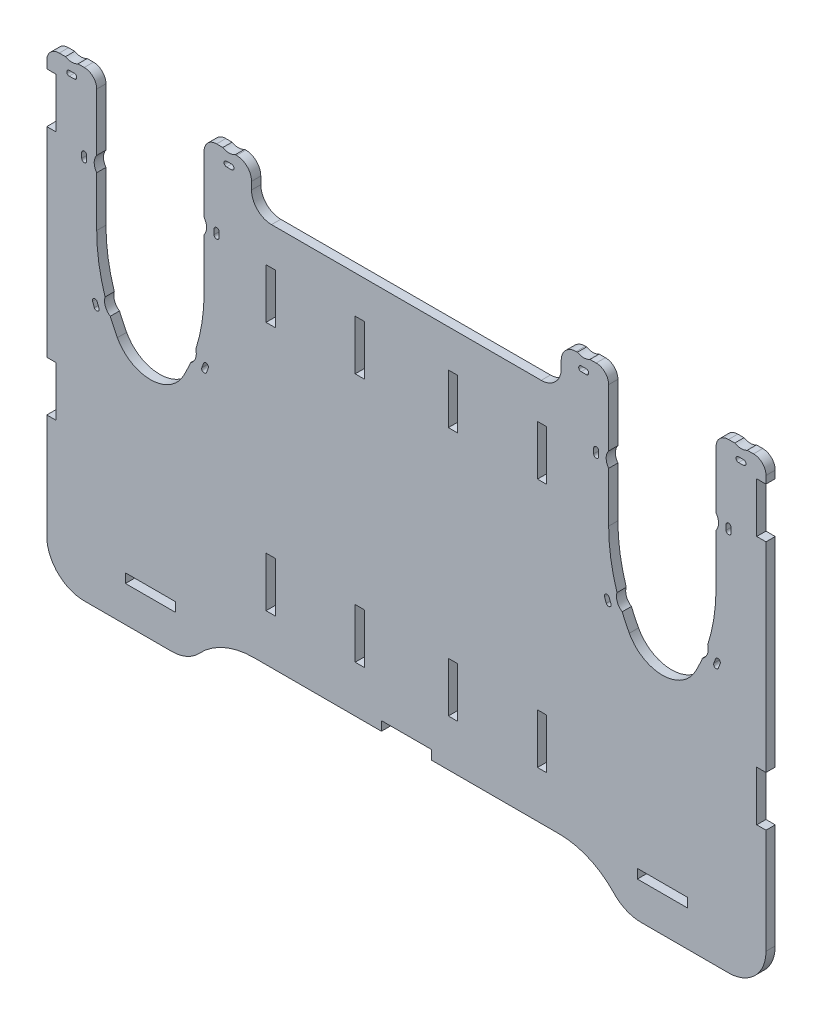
SolidWorks part; units mm, degrees
ref_plane "Front Plane" through (0, 0, 0) normal (0, 0, 1) x (1, 0, 0)
ref_plane "Top Plane" through (0, 0, 0) normal (0, 1, 0) x (1, 0, 0)
ref_plane "Right Plane" through (0, 0, 0) normal (1, 0, 0) x (0, 0, -1)
sketch "Sketch1" plane through (0, 0, 0) normal (0, 0, 1) x (1, 0, 0)
  line L0 (16.8, 115) -> (16.8, 35) construction
  line L1 (0, 150) -> (54, 150)
  line L2 (129, 167) -> (131.5, 167)
  line L3 (16.8, 135) -> (20.5, 135)
  line L4 (144, 162) -> (144, 159)
  line L5 (16.8, 135) -> (16.8, 115)
  line L6 (16.8, 115) -> (20.5, 115)
  line L7 (20.5, 135) -> (20.5, 115)
  line L8 (20.5, 135) -> (52.5, 135) construction
  line L9 (0, 0) -> (0, -18) construction
  line L10 (81, 162) -> (81, 139)
  line L11 (56.2, 115) -> (56.2, 35) construction
  line L12 (124, 162) -> (124, 139)
  line L13 (52.5, 135) -> (56.2, 135)
  line L14 (94, -18) -> (129, -18)
  line L15 (102.5, 87) -> (102.5, 72) construction
  line L16 (62, 158) -> (62, 161)
  line L17 (52.5, 135) -> (52.5, 115)
  line L18 (68, 167) -> (68.5, 167)
  line L19 (76, 136) -> (129, 136) construction
  line L20 (129, 135) -> (129, 137) construction
  line L21 (128, 135) -> (128, 137)
  line L22 (130, 135) -> (130, 137)
  line L23 (76, 135) -> (76, 137) construction
  line L24 (75, 135) -> (75, 137)
  line L25 (77, 135) -> (77, 137)
  line L26 (80.9736, 86.0617) -> (80.2819, 87.9383) construction
  line L27 (80.0353, 85.7159) -> (79.3436, 87.5925)
  line L28 (81.9119, 86.4075) -> (81.2202, 88.2841)
  line L29 (124.0264, 86.0617) -> (124.7181, 87.9383) construction
  line L30 (123.0881, 86.4075) -> (123.7798, 88.2841)
  line L31 (124.9647, 85.7159) -> (125.6564, 87.5925)
  line L32 (72, 162) -> (70, 162) construction
  line L33 (72, 161) -> (70, 161)
  line L34 (72, 163) -> (70, 163)
  line L35 (133, 162) -> (135, 162) construction
  line L36 (133, 163) -> (135, 163)
  line L37 (133, 161) -> (135, 161)
  line L38 (124.3722, 87) -> (80.6278, 87) construction
  line L39 (133, 162) -> (72, 162) construction
  line L40 (102.5, 162) -> (102.5, 136) construction
  line L41 (102.5, 136) -> (102.5, 87) construction
  line L42 (134, 167) -> (134, 162) construction
  line L43 (80.9736, 86.0617) -> (102.5, 86.0617) construction
  line L44 (85.3193, 88.7292) -> (81.5661, 87.3458) construction
  line L45 (124.0264, 86.0617) -> (102.5, 86.0617) construction
  line L46 (89.1328, 90.1347) -> (102.5, 90.1347) construction
  line L47 (102.5, 90.1347) -> (115.8672, 90.1347) construction
  line L48 (124, 133) -> (124, 112.9374)
  line L49 (81, 133) -> (81, 112.9374)
  line L50 (102.5, 0) -> (102.5, 72) construction
  line L51 (92.5, 0) -> (112.5, 0)
  line L52 (92.5, 0) -> (92.5, -3.7)
  line L53 (92.5, -3.7) -> (112.5, -3.7)
  line L54 (112.5, 0) -> (112.5, -3.7)
  line L55 (0, 0) -> (0, 150)
  line L56 (10, -3.7) -> (61.0985, -3.7)
  line L57 (52.5, 115) -> (56.2, 115)
  line L58 (56.2, 135) -> (56.2, 115)
  line L59 (16.8, 35) -> (20.5, 35)
  line L60 (16.8, 35) -> (16.8, 15)
  line L61 (16.8, 15) -> (20.5, 15)
  line L62 (20.5, 35) -> (20.5, 15)
  line L63 (20.5, 15) -> (52.5, 15) construction
  line L64 (144, 139) -> (144, 59)
  line L65 (52.5, 15) -> (56.2, 15)
  line L66 (52.5, 15) -> (52.5, 35)
  line L67 (52.5, 35) -> (56.2, 35)
  line L68 (56.2, 15) -> (56.2, 35)
  line L69 (144, 159) -> (140.3, 159)
  line L70 (144, 39) -> (144, -3)
  line L71 (144, 139) -> (140.3, 139)
  line L72 (140.3, 159) -> (140.3, 139)
  line L73 (144, 59) -> (140.3, 59)
  line L74 (0, 0) -> (10, 0)
  line L75 (144, 39) -> (140.3, 39)
  line L76 (140.3, 59) -> (140.3, 39)
  line L77 (10, 0) -> (10, -3.7)
  line L78 (71, 162) -> (71, 171.3301) construction
  line L79 (134, 167) -> (134, 171.3301) construction
  line L80 (136.5, 167) -> (139, 167)
  line L81 (73.5, 167) -> (76, 167)
  arc A0 (115.7273, 79.9262) -> (89.2727, 79.9262) centre (102.5, 87) cw
  arc A1 (129, 167) -> (124, 162) centre (129, 162) ccw
  arc A2 (76, 167) -> (81, 162) centre (76, 162) cw
  arc A3 (144, 162) -> (139, 167) centre (139, 162) ccw
  arc A4 (129, -18) -> (144, -3) centre (129, -3) ccw
  arc A5 (94, -18) -> (83.0328, -13.2333) centre (94, -3) cw
  arc A6 (83.0328, -13.2333) -> (61.0985, -3.7) centre (61.0985, -33.7) ccw
  arc A7 (68.5, 167) -> (73.5, 167) centre (71, 171.3301) ccw
  arc A8 (131.5, 167) -> (136.5, 167) centre (134, 171.3301) ccw
  arc A9 (68, 167) -> (62, 161) centre (68, 161) ccw
  arc A10 (54, 150) -> (62, 158) centre (54, 158) ccw
  arc A11 (115.7273, 79.9262) -> (118.5829, 85.9365) centre (54, 112.9374) ccw
  arc A12 (89.2727, 79.9262) -> (86.4171, 85.9365) centre (151, 112.9374) cw
  arc A13 (128, 135) -> (130, 135) centre (129, 135) ccw
  arc A14 (130, 137) -> (128, 137) centre (129, 137) ccw
  arc A15 (75, 135) -> (77, 135) centre (76, 135) ccw
  arc A16 (77, 137) -> (75, 137) centre (76, 137) ccw
  arc A17 (80.0353, 85.7159) -> (81.9119, 86.4075) centre (80.9736, 86.0617) ccw
  arc A18 (81.2202, 88.2841) -> (79.3436, 87.5925) centre (80.2819, 87.9383) ccw
  arc A19 (123.0881, 86.4075) -> (124.9647, 85.7159) centre (124.0264, 86.0617) ccw
  arc A20 (125.6564, 87.5925) -> (123.7798, 88.2841) centre (124.7181, 87.9383) ccw
  arc A21 (72, 161) -> (72, 163) centre (72, 162) ccw
  arc A22 (70, 163) -> (70, 161) centre (70, 162) ccw
  arc A23 (133, 163) -> (133, 161) centre (133, 162) ccw
  arc A24 (135, 161) -> (135, 163) centre (135, 162) ccw
  arc A25 (124, 133) -> (124, 139) centre (120, 136) ccw
  arc A26 (81, 139) -> (81, 133) centre (85, 136) ccw
  arc A27 (84.3421, 91.5663) -> (86.4171, 85.9365) centre (89.1328, 90.1347) ccw
  arc A28 (118.5829, 85.9365) -> (120.6579, 91.5663) centre (115.8672, 90.1347) ccw
  arc A29 (120.6579, 91.5663) -> (124, 112.9374) centre (54, 112.9374) ccw
  arc A30 (84.3421, 91.5663) -> (81, 112.9374) centre (151, 112.9374) cw
  point P13 (0, 0)
  point P51 (129, 136)
  point P57 (76, 136)
  point P65 (80.6278, 87)
  point P71 (124.3722, 87)
  point P78 (71, 162)
  point P85 (134, 162)
  dimension "D1" = 5
  dimension "D2" = 5
  dimension "D3" = 15
  dimension "D9" = 15
  dimension "D10" = 30
  dimension "D13" = 20
  dimension "D16" = 10
  dimension "D17" = 50
  dimension "D20" = 90
  dimension "D22" = 8
  dimension "D24" = 6
  dimension "D25" = 15
  dimension "D26" = 70
  dimension "D27" = 2
  dimension "D35" = 10
  dimension "D43" = 288
  dimension "D5" = 43
  dimension "D6" = 3.7
  dimension "D7" = 32
  dimension "D8" = 150
  dimension "D11" = 105
  dimension "D12" = 205
  dimension "D14" = 15
  dimension "D15" = 80
  dimension "D18" = 20
  dimension "D19" = 3.7
  dimension "D21" = 185
  dimension "D23" = 54
  dimension "D28" = 8
  dimension "D29" = 80
  dimension "D30" = 2
  dimension "D31" = 4
  dimension "D32" = 4
  dimension "D33" = 4
  dimension "D34" = 26
  dimension "D36" = 6
  dimension "D37" = 6
  dimension "D38" = 5
  dimension "D39" = 20
  dimension "D40" = 63
  dimension "D41" = 72
  dimension "D42" = 18
  dimension "D44" = 15
  dimension "D45" = 3.7
  dimension "D46" = 20
extrude "Extrude1" add sketch "Sketch1" along normal blind 3.7
mirror "Mirror1" about plane through (0, 0, 0) normal (1, 0, 0) of "Extrude1"
ref_plane "Plane1" through (102.5, 0, 0) normal (1, 0, 0) x (0, 0, -1)
